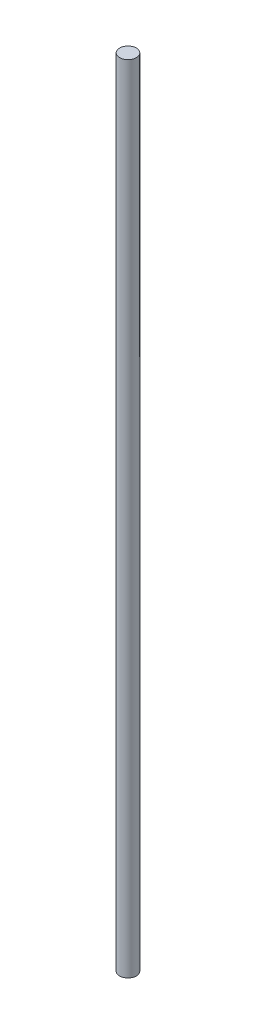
SolidWorks part; units mm, degrees
ref_plane "Front Plane" through (0, 0, 0) normal (0, 0, 1) x (1, 0, 0)
ref_plane "Top Plane" through (0, 0, 0) normal (0, 1, 0) x (1, 0, 0)
ref_plane "Right Plane" through (0, 0, 0) normal (1, 0, 0) x (0, 0, -1)
sketch "Sketch1" plane through (0, 0, 0) normal (0, 1, 0) x (1, 0, 0)
  circle A0 centre (0, 0) radius 3.15
  dimension "D1" = 6.3
extrude "Boss-Extrude1" add sketch "Sketch1" along normal blind 300
